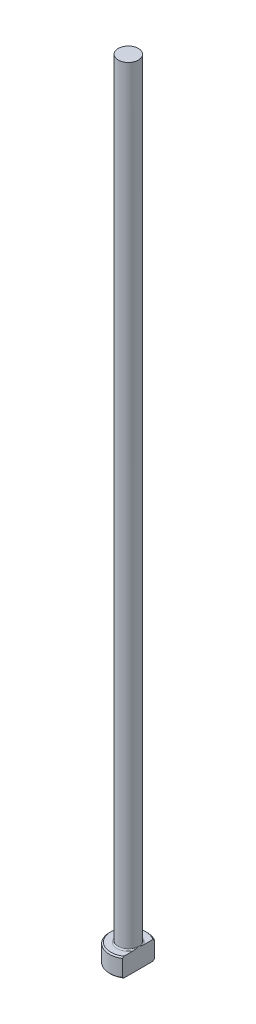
SolidWorks part; units mm, degrees
ref_plane "Front Plane" through (0, 0, 0) normal (0, 0, 1) x (1, 0, 0)
ref_plane "Top Plane" through (0, 0, 0) normal (0, 1, 0) x (1, 0, 0)
ref_plane "Right Plane" through (0, 0, 0) normal (1, 0, 0) x (0, 0, -1)
sketch "Sketch1" plane through (0, 0, 0) normal (0, 0, 1) x (1, 0, 0)
  line L0 (0, 259.9588) -> (0, -15.1925) construction
  line L1 (0, 0) -> (-3, 0)
  line L2 (-3, 0) -> (-3, 3)
  line L3 (-3, 3) -> (-1.6, 3)
  line L4 (-1.6, 3) -> (-1.6, 125)
  line L5 (-1.6, 125) -> (0, 125)
  line L6 (0, 125) -> (0, 0)
  dimension "L" = 125
  dimension "H" = 6
  dimension "T" = 3
  dimension "D" = 3.2
revolve "Revolve1" add sketch "Sketch1" angle 360 about L0
chamfer "Chamfer1" distance 0.2 angle 45 2 edges at (0, 3, 3) (0, 0, 3)
fillet "Fillet1" radius 0.2 1 edges at (0, 3, 1.6)
sketch "Sketch2" plane through (0, 0, 0) normal (0, 1, 0) x (1, 0, 0)
  line L0 (1.6, 2.5377) -> (1.6, -2.5377)
  circle A0 centre (0, 0) radius 3 construction
  arc A1 (1.6, -2.5377) -> (1.6, 2.5377) centre (0, 0) ccw
  circle A2 centre (0, 0) radius 1.6 construction
extrude "KEY" cut sketch "Sketch2" along normal through all
